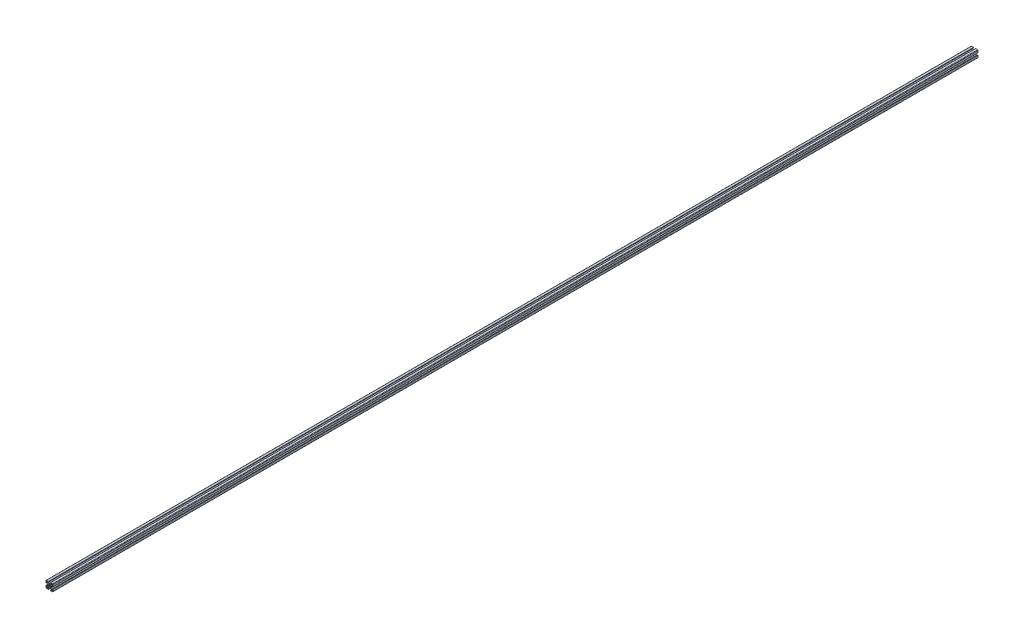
SolidWorks part; units mm, degrees
ref_plane "Front Plane" through (0, 0, 0) normal (0, 0, 1) x (1, 0, 0)
ref_plane "Top Plane" through (0, 0, 0) normal (0, 1, 0) x (1, 0, 0)
ref_plane "Right Plane" through (0, 0, 0) normal (1, 0, 0) x (0, 0, -1)
sketch "Sketch1" plane through (0, 0, 0) normal (0, 0, 1) x (1, 0, 0)
  line L0 (9.5, -13.3189) -> (9.5, -9.88)
  line L1 (9.88, -9.5) -> (13.3189, -9.5)
  line L2 (13.6999, -9.881) -> (13.6999, -12.6999)
  line L3 (12.6999, -13.6999) -> (9.881, -13.6999)
  line L4 (-13.3189, -9.5) -> (-9.88, -9.5)
  line L5 (-9.5, -9.88) -> (-9.5, -13.3189)
  line L6 (-9.881, -13.6999) -> (-12.6999, -13.6999)
  line L7 (-13.6999, -12.6999) -> (-13.6999, -9.881)
  line L8 (-1.4942, -3.1981) -> (-2.4733, -3.9799)
  line L9 (-3.9799, -2.4733) -> (-3.1981, -1.4942)
  line L10 (-3.1981, 1.4942) -> (-3.9799, 2.4733)
  line L11 (-2.4733, 3.9799) -> (-1.4942, 3.1981)
  line L12 (1.4942, 3.1981) -> (2.4733, 3.9799)
  line L13 (3.9799, 2.4733) -> (3.1981, 1.4942)
  line L14 (3.1981, -1.4942) -> (3.9799, -2.4733)
  line L15 (2.4733, -3.9799) -> (1.4942, -3.1981)
  line L16 (-9.5, 13.3189) -> (-9.5, 9.88)
  line L17 (-9.88, 9.5) -> (-13.3189, 9.5)
  line L18 (-13.6999, 9.881) -> (-13.6999, 12.6999)
  line L19 (-12.6999, 13.6999) -> (-9.881, 13.6999)
  line L20 (9.881, 13.6999) -> (12.6999, 13.6999)
  line L21 (13.6999, 12.6999) -> (13.6999, 9.881)
  line L22 (13.3189, 9.5) -> (9.88, 9.5)
  line L23 (9.5, 9.88) -> (9.5, 13.3189)
  line L24 (12.7425, -4.5) -> (12.7425, -7.7325)
  line L25 (12.2428, -8.25) -> (10.2602, -8.25)
  line L26 (9.9066, -8.1035) -> (5.9811, -4.178)
  line L27 (5.8347, -3.8245) -> (5.8347, -1.0125)
  line L28 (5.8347, -1.0125) -> (5.3247, -0.0625)
  line L29 (5.3247, -0.0625) -> (5.8347, 0.8875)
  line L30 (5.8347, 0.8875) -> (5.8347, 3.8245)
  line L31 (5.9811, 4.178) -> (9.9066, 8.1035)
  line L32 (10.2602, 8.25) -> (12.2428, 8.25)
  line L33 (12.7425, 7.7325) -> (12.7425, 4.5)
  line L34 (13.2425, 4) -> (14.4999, 4)
  line L35 (14.9999, 4.5) -> (14.9999, 12.9999)
  line L36 (12.9999, 14.9999) -> (4.5, 14.9999)
  line L37 (4, 14.4999) -> (4, 13.2425)
  line L38 (4.5, 12.7425) -> (7.7325, 12.7425)
  line L39 (8.25, 12.2428) -> (8.25, 10.2602)
  line L40 (8.1035, 9.9066) -> (4.178, 5.9811)
  line L41 (3.8245, 5.8347) -> (0.95, 5.8347)
  line L42 (0.95, 5.8347) -> (0, 5.3247)
  line L43 (0, 5.3247) -> (-0.95, 5.8347)
  line L44 (-0.95, 5.8347) -> (-3.8245, 5.8347)
  line L45 (-4.178, 5.9811) -> (-8.1035, 9.9066)
  line L46 (-8.25, 10.2602) -> (-8.25, 12.2428)
  line L47 (-7.7325, 12.7425) -> (-4.5, 12.7425)
  line L48 (-4, 13.2425) -> (-4, 14.4999)
  line L49 (-4.5, 14.9999) -> (-12.9999, 14.9999)
  line L50 (-14.9999, 12.9999) -> (-14.9999, 4.5)
  line L51 (-14.4999, 4) -> (-13.2425, 4)
  line L52 (-12.7425, 4.5) -> (-12.7425, 7.7325)
  line L53 (-12.2428, 8.25) -> (-10.2602, 8.25)
  line L54 (-9.9066, 8.1035) -> (-5.9811, 4.178)
  line L55 (-5.8347, 3.8245) -> (-5.8347, 0.8875)
  line L56 (-5.8347, 0.8875) -> (-5.3247, -0.0625)
  line L57 (-5.3247, -0.0625) -> (-5.8347, -1.0125)
  line L58 (-5.8347, -1.0125) -> (-5.8347, -3.8245)
  line L59 (-5.9811, -4.178) -> (-9.9066, -8.1035)
  line L60 (-10.2602, -8.25) -> (-12.2428, -8.25)
  line L61 (-12.7425, -7.7325) -> (-12.7425, -4.5)
  line L62 (-13.2425, -4) -> (-14.4999, -4)
  line L63 (-14.9999, -4.5) -> (-14.9999, -12.9999)
  line L64 (-12.9999, -14.9999) -> (-4.5, -14.9999)
  line L65 (-4, -14.4999) -> (-4, -13.2425)
  line L66 (-4.5, -12.7425) -> (-7.7325, -12.7425)
  line L67 (-8.25, -12.2428) -> (-8.25, -10.2602)
  line L68 (-8.1035, -9.9066) -> (-4.178, -5.9811)
  line L69 (-3.8245, -5.8347) -> (-0.95, -5.8347)
  line L70 (-0.95, -5.8347) -> (0, -5.3247)
  line L71 (0, -5.3247) -> (0.95, -5.8347)
  line L72 (0.95, -5.8347) -> (3.8245, -5.8347)
  line L73 (4.178, -5.9811) -> (8.1035, -9.9066)
  line L74 (8.25, -10.2602) -> (8.25, -12.2428)
  line L75 (7.7325, -12.7425) -> (4.5, -12.7425)
  line L76 (4, -13.2425) -> (4, -14.4999)
  line L77 (4.5, -14.9999) -> (12.9999, -14.9999)
  line L78 (14.9999, -12.9999) -> (14.9999, -4.5)
  line L79 (14.4999, -4) -> (13.2425, -4)
  arc A0 (9.5, -13.3189) -> (9.881, -13.6999) centre (9.881, -13.3189) ccw
  arc A1 (9.88, -9.5) -> (9.5, -9.88) centre (9.88, -9.88) ccw
  arc A2 (13.6999, -9.881) -> (13.3189, -9.5) centre (13.3189, -9.881) ccw
  arc A3 (12.6999, -13.6999) -> (13.6999, -12.6999) centre (12.6999, -12.6999) ccw
  arc A4 (-13.3189, -9.5) -> (-13.6999, -9.881) centre (-13.3189, -9.881) ccw
  arc A5 (-9.5, -9.88) -> (-9.88, -9.5) centre (-9.88, -9.88) ccw
  arc A6 (-9.881, -13.6999) -> (-9.5, -13.3189) centre (-9.881, -13.3189) ccw
  arc A7 (-13.6999, -12.6999) -> (-12.6999, -13.6999) centre (-12.6999, -12.6999) ccw
  arc A8 (-1.4942, -3.1981) -> (1.4942, -3.1981) centre (0, 0) ccw
  arc A9 (-3.9799, -2.4733) -> (-2.4733, -3.9799) centre (-3.1422, -3.1422) ccw
  arc A10 (-3.1981, 1.4942) -> (-3.1981, -1.4942) centre (0, 0) ccw
  arc A11 (-2.4733, 3.9799) -> (-3.9799, 2.4733) centre (-3.1422, 3.1422) ccw
  arc A12 (1.4942, 3.1981) -> (-1.4942, 3.1981) centre (0, 0) ccw
  arc A13 (3.9799, 2.4733) -> (2.4733, 3.9799) centre (3.1422, 3.1422) ccw
  arc A14 (3.1981, -1.4942) -> (3.1981, 1.4942) centre (0, 0) ccw
  arc A15 (2.4733, -3.9799) -> (3.9799, -2.4733) centre (3.1422, -3.1422) ccw
  arc A16 (-9.5, 13.3189) -> (-9.881, 13.6999) centre (-9.881, 13.3189) ccw
  arc A17 (-9.88, 9.5) -> (-9.5, 9.88) centre (-9.88, 9.88) ccw
  arc A18 (-13.6999, 9.881) -> (-13.3189, 9.5) centre (-13.3189, 9.881) ccw
  arc A19 (-12.6999, 13.6999) -> (-13.6999, 12.6999) centre (-12.6999, 12.6999) ccw
  arc A20 (9.881, 13.6999) -> (9.5, 13.3189) centre (9.881, 13.3189) ccw
  arc A21 (13.6999, 12.6999) -> (12.6999, 13.6999) centre (12.6999, 12.6999) ccw
  arc A22 (13.3189, 9.5) -> (13.6999, 9.881) centre (13.3189, 9.881) ccw
  arc A23 (9.5, 9.88) -> (9.88, 9.5) centre (9.88, 9.88) ccw
  arc A24 (13.2425, -4) -> (12.7425, -4.5) centre (13.2425, -4.5) ccw
  arc A25 (12.2428, -8.25) -> (12.7425, -7.7325) centre (12.2428, -7.75) ccw
  arc A26 (9.9066, -8.1035) -> (10.2602, -8.25) centre (10.2602, -7.75) ccw
  arc A27 (5.8347, -3.8245) -> (5.9811, -4.178) centre (6.3347, -3.8245) ccw
  arc A28 (5.9811, 4.178) -> (5.8347, 3.8245) centre (6.3347, 3.8245) ccw
  arc A29 (10.2602, 8.25) -> (9.9066, 8.1035) centre (10.2602, 7.75) ccw
  arc A30 (12.7425, 7.7325) -> (12.2428, 8.25) centre (12.2428, 7.75) ccw
  arc A31 (12.7425, 4.5) -> (13.2425, 4) centre (13.2425, 4.5) ccw
  arc A32 (14.4999, 4) -> (14.9999, 4.5) centre (14.4999, 4.5) ccw
  arc A33 (14.9999, 12.9999) -> (12.9999, 14.9999) centre (12.9999, 12.9999) ccw
  arc A34 (4.5, 14.9999) -> (4, 14.4999) centre (4.5, 14.4999) ccw
  arc A35 (4, 13.2425) -> (4.5, 12.7425) centre (4.5, 13.2425) ccw
  arc A36 (8.25, 12.2428) -> (7.7325, 12.7425) centre (7.75, 12.2428) ccw
  arc A37 (8.1035, 9.9066) -> (8.25, 10.2602) centre (7.75, 10.2602) ccw
  arc A38 (3.8245, 5.8347) -> (4.178, 5.9811) centre (3.8245, 6.3347) ccw
  arc A39 (-4.178, 5.9811) -> (-3.8245, 5.8347) centre (-3.8245, 6.3347) ccw
  arc A40 (-8.25, 10.2602) -> (-8.1035, 9.9066) centre (-7.75, 10.2602) ccw
  arc A41 (-7.7325, 12.7425) -> (-8.25, 12.2428) centre (-7.75, 12.2428) ccw
  arc A42 (-4.5, 12.7425) -> (-4, 13.2425) centre (-4.5, 13.2425) ccw
  arc A43 (-4, 14.4999) -> (-4.5, 14.9999) centre (-4.5, 14.4999) ccw
  arc A44 (-12.9999, 14.9999) -> (-14.9999, 12.9999) centre (-12.9999, 12.9999) ccw
  arc A45 (-14.9999, 4.5) -> (-14.4999, 4) centre (-14.4999, 4.5) ccw
  arc A46 (-13.2425, 4) -> (-12.7425, 4.5) centre (-13.2425, 4.5) ccw
  arc A47 (-12.2428, 8.25) -> (-12.7425, 7.7325) centre (-12.2428, 7.75) ccw
  arc A48 (-9.9066, 8.1035) -> (-10.2602, 8.25) centre (-10.2602, 7.75) ccw
  arc A49 (-5.8347, 3.8245) -> (-5.9811, 4.178) centre (-6.3347, 3.8245) ccw
  arc A50 (-5.9811, -4.178) -> (-5.8347, -3.8245) centre (-6.3347, -3.8245) ccw
  arc A51 (-10.2602, -8.25) -> (-9.9066, -8.1035) centre (-10.2602, -7.75) ccw
  arc A52 (-12.7425, -7.7325) -> (-12.2428, -8.25) centre (-12.2428, -7.75) ccw
  arc A53 (-12.7425, -4.5) -> (-13.2425, -4) centre (-13.2425, -4.5) ccw
  arc A54 (-14.4999, -4) -> (-14.9999, -4.5) centre (-14.4999, -4.5) ccw
  arc A55 (-14.9999, -12.9999) -> (-12.9999, -14.9999) centre (-12.9999, -12.9999) ccw
  arc A56 (-4.5, -14.9999) -> (-4, -14.4999) centre (-4.5, -14.4999) ccw
  arc A57 (-4, -13.2425) -> (-4.5, -12.7425) centre (-4.5, -13.2425) ccw
  arc A58 (-8.25, -12.2428) -> (-7.7325, -12.7425) centre (-7.75, -12.2428) ccw
  arc A59 (-8.1035, -9.9066) -> (-8.25, -10.2602) centre (-7.75, -10.2602) ccw
  arc A60 (-3.8245, -5.8347) -> (-4.178, -5.9811) centre (-3.8245, -6.3347) ccw
  arc A61 (4.178, -5.9811) -> (3.8245, -5.8347) centre (3.8245, -6.3347) ccw
  arc A62 (8.25, -10.2602) -> (8.1035, -9.9066) centre (7.75, -10.2602) ccw
  arc A63 (7.7325, -12.7425) -> (8.25, -12.2428) centre (7.75, -12.2428) ccw
  arc A64 (4.5, -12.7425) -> (4, -13.2425) centre (4.5, -13.2425) ccw
  arc A65 (4, -14.4999) -> (4.5, -14.9999) centre (4.5, -14.4999) ccw
  arc A66 (12.9999, -14.9999) -> (14.9999, -12.9999) centre (12.9999, -12.9999) ccw
  arc A67 (14.9999, -4.5) -> (14.4999, -4) centre (14.4999, -4.5) ccw
extrude "Extrude1" add sketch "Sketch1" against normal blind 4000
